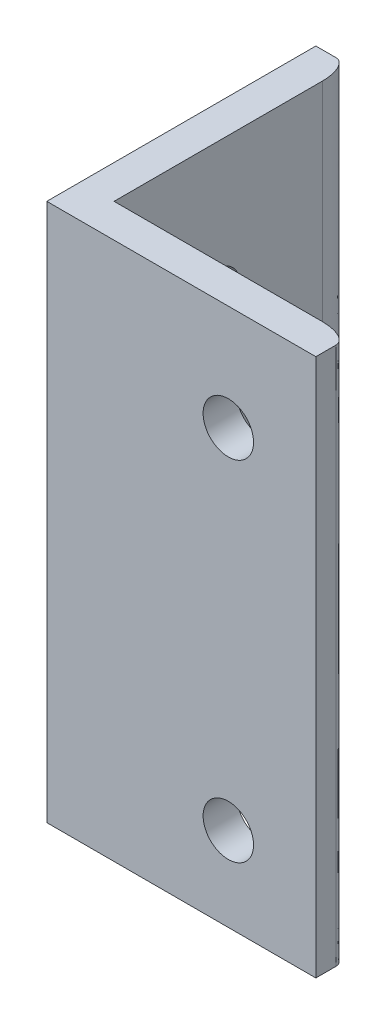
SolidWorks part; units mm, degrees
other "<Small L Bracket>-<Cut-Extrude2>"
ref_plane "Front Plane" through (0, 0, 0) normal (0, 0, 1) x (1, 0, 0)
ref_plane "Top Plane" through (0, 0, 0) normal (0, 1, 0) x (1, 0, 0)
ref_plane "Right Plane" through (0, 0, 0) normal (1, 0, 0) x (0, 0, -1)
mirrored part "Small L Bracket_Mirrored"
